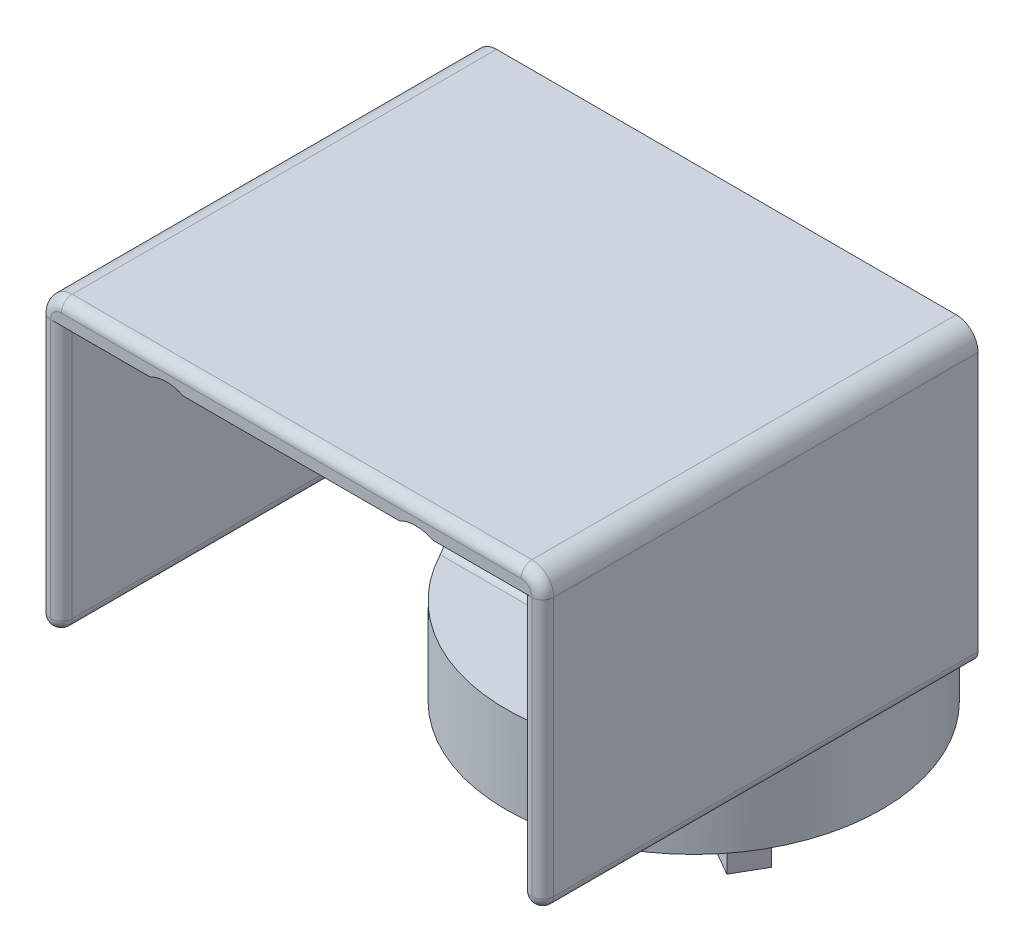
SolidWorks part; units mm, degrees
ref_plane "Front Plane" through (0, 0, 0) normal (0, 0, 1) x (1, 0, 0)
ref_plane "Top Plane" through (0, 0, 0) normal (0, 1, 0) x (1, 0, 0)
ref_plane "Right Plane" through (0, 0, 0) normal (1, 0, 0) x (0, 0, -1)
other "Join1"
other "LIDAR mount<2>@top of lidar gear"
other "lidar holder<1>@top of lidar gear"
fillet "Fillet4" radius 1.27 4 edges at (-29.0387, 26.0328, -10.16) (-4.8993, 26.0328, -10.16) (-5.6738, 26.0328, 2.54) (-28.2642, 26.0328, 2.54)
sketch "Sketch1" plane through (0, 0, 2.54) normal (0, 0, 1) x (1, 0, 0)
  line L0 (12.4061, 33.6528) -> (12.4061, 63.9042) construction
  line L1 (9.8661, 66.4442) -> (-43.8041, 66.4442) construction
  line L2 (-46.3441, 63.9042) -> (-46.3441, 33.6528) construction
  line L3 (12.4061, 33.6528) -> (12.4061, 63.9042)
  line L4 (9.8661, 66.4442) -> (-43.8041, 66.4442)
  line L5 (-46.3441, 63.9042) -> (-46.3441, 33.6528)
  line L6 (9.8661, 33.6528) -> (9.8661, 63.9042)
  line L7 (9.8661, 63.9042) -> (-0.4917, 63.9042)
  line L8 (-43.8041, 63.9042) -> (-43.8041, 33.6528)
  line L9 (-43.6766, 32.3828) -> (-45.0741, 32.3828) construction
  line L11 (-33.4462, 63.9042) -> (-43.8041, 63.9042)
  line L12 (-4.3632, 63.9042) -> (-29.5747, 63.9042)
  line L13 (9.8661, 63.9042) -> (-43.8041, 63.9042) construction
  arc A0 (12.4061, 63.9042) -> (9.8661, 66.4442) centre (9.8661, 63.9042) ccw construction
  arc A1 (-43.8041, 66.4442) -> (-46.3441, 63.9042) centre (-43.8041, 63.9042) ccw construction
  arc A2 (12.4061, 63.9042) -> (9.8661, 66.4442) centre (9.8661, 63.9042) ccw
  arc A3 (-43.8041, 66.4442) -> (-46.3441, 63.9042) centre (-43.8041, 63.9042) ccw
  arc A4 (9.8661, 63.9042) -> (9.8661, 63.9042) centre (9.8661, 63.9042) ccw
  arc A5 (-43.8041, 63.9042) -> (-43.8041, 63.9042) centre (-43.8041, 63.9042) ccw
  arc A6 (1.8461, 60.0942) -> (-6.701, 60.0942) centre (-2.4275, 60.0942) ccw construction
  arc A7 (-27.2369, 60.0942) -> (-35.784, 60.0942) centre (-31.5105, 60.0942) ccw construction
  arc A8 (-0.4917, 63.9042) -> (-4.3632, 63.9042) centre (-2.4275, 60.0942) ccw
  arc A9 (-29.5747, 63.9042) -> (-33.4462, 63.9042) centre (-31.5105, 60.0942) ccw
  arc A10 (11.1361, 32.3828) -> (12.4061, 33.6528) centre (11.1361, 33.6528) ccw construction
  arc A11 (-46.3441, 33.6528) -> (-45.0741, 32.3828) centre (-45.0741, 33.6528) ccw construction
  arc A12 (11.1361, 32.3828) -> (12.4061, 33.6528) centre (11.1361, 33.6528) ccw
  arc A13 (-46.3441, 33.6528) -> (-45.0741, 32.3828) centre (-45.0741, 33.6528) ccw
  arc A14 (-43.8041, 33.6528) -> (-45.0741, 32.3828) centre (-45.0741, 33.6528) cw
  arc A15 (9.8661, 33.6528) -> (11.1361, 32.3828) centre (11.1361, 33.6528) ccw
  dimension "D1" = 2.54
extrude "Boss-Extrude1" add sketch "Sketch1" along normal blind 38.1
fillet "Fillet5" radius 1.27 9 edges at (9.8661, 48.7785, 40.64) (11.1361, 32.3828, 40.64) (12.4061, 48.7785, 40.64) (11.6622, 65.7003, 40.64) (-16.969, 66.4442, 40.64) (-45.6001, 65.7003, 40.64) (-43.8041, 48.7785, 40.64) (-45.0741, 32.3828, 40.64) (-46.3441, 48.7785, 40.64)
